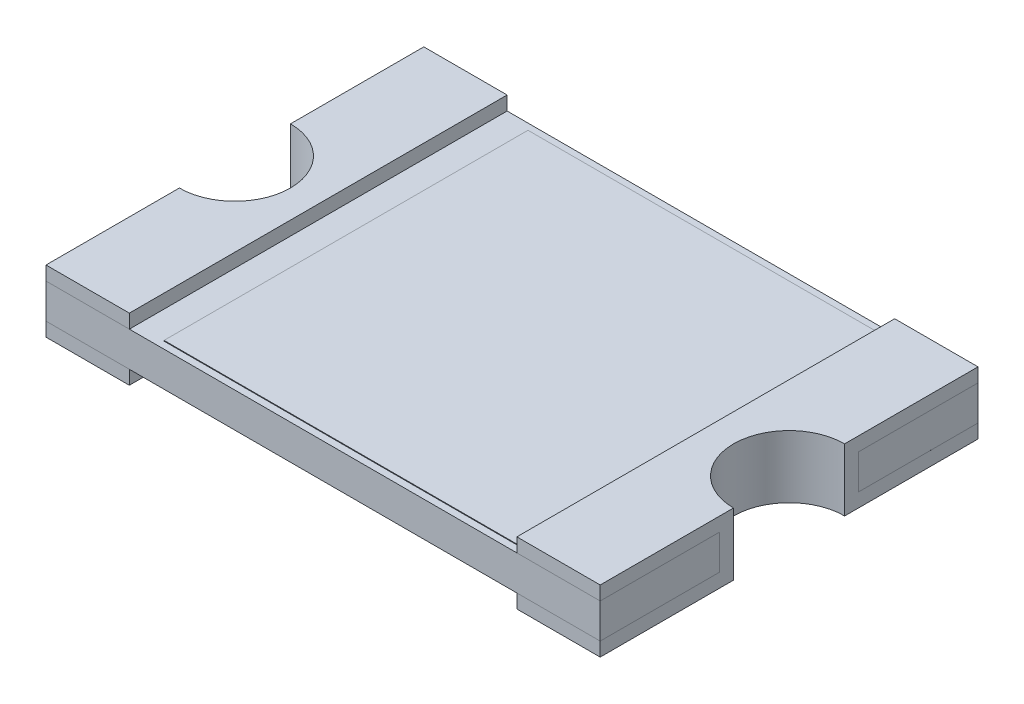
SolidWorks part; units mm, degrees
ref_plane "Front Plane" through (0, 0, 0) normal (0, 0, 1) x (1, 0, 0)
ref_plane "Top Plane" through (0, 0, 0) normal (0, 1, 0) x (1, 0, 0)
ref_plane "Right Plane" through (0, 0, 0) normal (1, 0, 0) x (0, 0, -1)
sketch "Sketch2" plane through (0, 0, 0) normal (0, 1, 0) x (1, 0, 0)
  line L0 (-2.79, -2.72) -> (-2.79, 2.72) construction
  line L1 (-3.99, 2.72) -> (3.99, 2.72) construction
  line L2 (-3.99, 2.72) -> (-3.99, -2.72) construction
  line L3 (-3.99, -2.72) -> (3.99, -2.72) construction
  line L4 (3.99, 2.72) -> (3.99, -2.72) construction
  line L5 (2.79, 2.72) -> (2.79, -2.72) construction
  line L6 (-3.99, 0) -> (-2.79, 0) construction
  line L7 (3.99, 0) -> (2.79, 0) construction
  line L8 (-2.39, 2.62) -> (-2.39, -2.62) construction
  line L9 (-2.39, 2.62) -> (2.79, 2.62) construction
  line L10 (-2.39, -2.62) -> (2.79, -2.62) construction
  arc A0 (-3.99, 0.8) -> (-3.99, -0.8) centre (-3.99, 0) cw construction
  arc A1 (3.99, 0.8) -> (3.99, -0.8) centre (3.99, 0) ccw construction
  arc A2 (3.99, 1) -> (3.99, -1) centre (3.99, 0) ccw construction
  arc A3 (-3.99, 1) -> (-3.99, -1) centre (-3.99, 0) cw construction
  point P4 (-3.99, 0)
  point P6 (0, -2.72)
  point P17 (3.99, 0)
  point P35 (-2.39, 0)
  dimension "D1" = 0.8
  dimension "D2" = 1.2
  dimension "D3" = 7.98
  dimension "D4" = 5.44
  dimension "D5" = 0.4
  dimension "D6" = 0.2
  dimension "D7" = 0.1
sketch "Sketch3" plane through (0, 0, 0) normal (0, 0, 1) x (1, 0, 0)
  line L0 (-3.99, 0.7) -> (3.99, 0.7) construction
  line L1 (-3.99, 0.9) -> (3.99, 0.9) construction
  line L2 (-3.99, 0.9) -> (-3.99, 0) construction
  line L3 (-3.99, 0) -> (3.99, 0) construction
  line L4 (3.99, 0.9) -> (3.99, 0) construction
  line L5 (-3.99, 0.2) -> (3.99, 0.2) construction
  line L6 (0, 0.7) -> (0, 0.2) construction
  line L7 (0, 0.2) -> (0, 0) construction
  line L8 (0, 0.7) -> (0, 0.9) construction
  line L9 (-2.79, 0.9) -> (-2.79, 0) construction
  line L10 (2.79, 0.9) -> (2.79, 0) construction
  line L11 (-2.39, 0.7) -> (-2.39, 0.71) construction
  line L12 (-2.39, 0.71) -> (2.79, 0.71) construction
  point P7 (0, 0)
  point P20 (0, 0)
  dimension "D1" = 0.9
  dimension "D2" = 0.5
  dimension "D3" = 0.01
sketch "Sketch4" plane through (0, 0, 0) normal (0, 0, 1) x (1, 0, 0)
  line L1 (-3.99, 0.7) -> (3.99, 0.7)
  line L2 (-3.99, 0.7) -> (-3.99, 0.2)
  line L3 (-3.99, 0.2) -> (3.99, 0.2)
  line L4 (3.99, 0.7) -> (3.99, 0.2)
extrude "Boss-Extrude1" add sketch "Sketch4" against normal up to vertex (2.72 mm away) from vertex at 2.72
sketch "Sketch7" plane through (0, 0, 0) normal (0, 0, 1) x (1, 0, 0)
  line L1 (-3.99, 0.7) -> (-2.79, 0.7)
  line L2 (-3.99, 0.7) -> (-3.99, 0.9)
  line L3 (-3.99, 0.9) -> (-2.79, 0.9)
  line L4 (-2.79, 0.7) -> (-2.79, 0.9)
  line L5 (-3.99, 0.2) -> (-2.79, 0.2)
  line L6 (-3.99, 0.2) -> (-3.99, 0)
  line L7 (-3.99, 0) -> (-2.79, 0)
  line L8 (-2.79, 0.2) -> (-2.79, 0)
  line L9 (3.99, 0.7) -> (2.79, 0.7)
  line L10 (3.99, 0.7) -> (3.99, 0.9)
  line L11 (3.99, 0.9) -> (2.79, 0.9)
  line L12 (2.79, 0.7) -> (2.79, 0.9)
  line L13 (3.99, 0.2) -> (2.79, 0.2)
  line L14 (3.99, 0.2) -> (3.99, 0)
  line L15 (3.99, 0) -> (2.79, 0)
  line L16 (2.79, 0.2) -> (2.79, 0)
extrude "Boss-Extrude2" add sketch "Sketch7" against normal up to vertex (2.72 mm away) from vertex at 2.72 separate body
sketch "Sketch6" plane through (0, 0, 0) normal (0, 1, 0) x (1, 0, 0)
  line L4 (3.99, 2.72) -> (3.99, -2.72) construction
  line L5 (-3.99, 2.72) -> (-3.99, -2.72) construction
  line L6 (3.99, 1) -> (3.99, -1)
  line L7 (-3.99, 1) -> (-3.99, -1)
  arc A4 (3.99, 1) -> (3.99, -1) centre (3.99, 0) ccw construction
  arc A5 (-3.99, -1) -> (-3.99, 1) centre (-3.99, 0) ccw construction
  arc A6 (3.99, 1) -> (3.99, -1) centre (3.99, 0) ccw
  arc A7 (-3.99, -1) -> (-3.99, 1) centre (-3.99, 0) ccw
extrude "Cut-Extrude1" cut sketch "Sketch6" along normal through all
sketch "Sketch9" plane through (0, 0, 0) normal (0, 1, 0) x (1, 0, 0)
  line L0 (3.99, 2.72) -> (3.99, -2.72) construction
  line L1 (-3.99, 2.72) -> (-3.99, -2.72) construction
  line L2 (3.99, 1) -> (3.99, 0.8)
  line L3 (-3.99, 1) -> (-3.99, 0.8)
  line L4 (-3.99, -0.8) -> (-3.99, -1)
  line L5 (3.99, -0.8) -> (3.99, -1)
  arc A0 (3.99, 1) -> (3.99, -1) centre (3.99, 0) ccw construction
  arc A1 (3.99, 0.8) -> (3.99, -0.8) centre (3.99, 0) ccw construction
  arc A2 (-3.99, -1) -> (-3.99, 1) centre (-3.99, 0) ccw construction
  arc A3 (-3.99, -0.8) -> (-3.99, 0.8) centre (-3.99, 0) ccw construction
  arc A4 (3.99, 1) -> (3.99, -1) centre (3.99, 0) ccw
  arc A5 (3.99, 0.8) -> (3.99, -0.8) centre (3.99, 0) ccw
  arc A6 (-3.99, -1) -> (-3.99, 1) centre (-3.99, 0) ccw
  arc A7 (-3.99, -0.8) -> (-3.99, 0.8) centre (-3.99, 0) ccw
extrude "Boss-Extrude3" add sketch "Sketch9" along normal up to vertex (0.9 mm away) from vertex at 0
sketch "Sketch11" plane through (0, 0, 0) normal (0, 1, 0) x (1, 0, 0)
  line L1 (-2.39, 2.62) -> (2.79, 2.62)
  line L2 (-2.39, 2.62) -> (-2.39, -2.62)
  line L3 (-2.39, -2.62) -> (2.79, -2.62)
  line L4 (2.79, 2.62) -> (2.79, -2.62)
extrude "Boss-Extrude4" add sketch "Sketch11" along normal up to vertex (0.71 mm away) from vertex at 0.7 separate body
